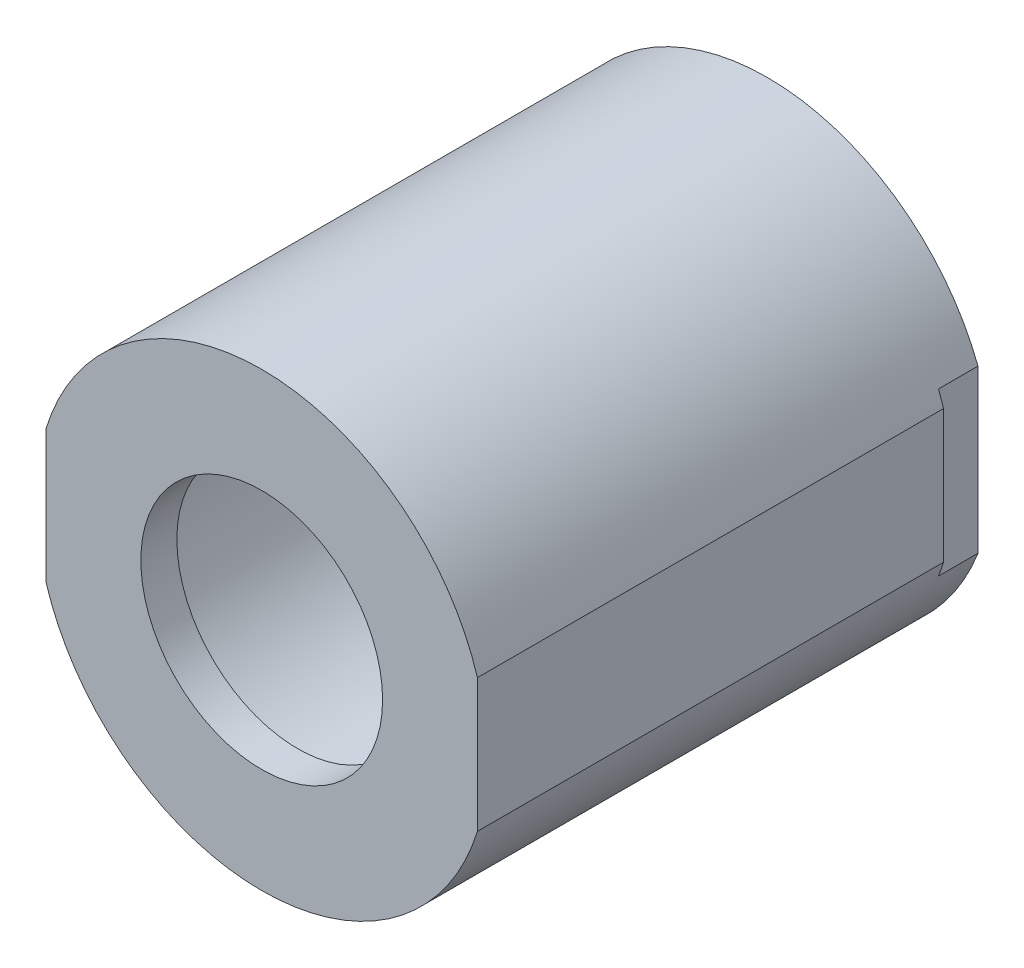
SolidWorks part; units mm, degrees
ref_plane "Front Plane" through (0, 0, 0) normal (0, 0, 1) x (1, 0, 0)
ref_plane "Top Plane" through (0, 0, 0) normal (0, 1, 0) x (1, 0, 0)
ref_plane "Right Plane" through (0, 0, 0) normal (1, 0, 0) x (0, 0, -1)
sketch "Sketch1" plane through (0, 0, 0) normal (0, 0, 1) x (1, 0, 0)
  circle A0 centre (0, 0) radius 28.575
  dimension "D1" = 57.15
extrude "Boss-Extrude1" add sketch "Sketch1" along normal blind 64
sketch "Sketch2" plane through (0, 0, 64) normal (0, 0, 1) x (1, 0, 0)
  circle A0 centre (0, 0) radius 15.3
  dimension "D1" = 30.6
extrude "Cut-Extrude1" cut sketch "Sketch2" against normal up to next
sketch "Sketch3" plane through (0, 0, 0) normal (0, 0, -1) x (-1, 0, 0)
  circle A0 centre (0, 0) radius 21.4312
  dimension "D1" = 42.8625
extrude "Cut-Extrude2" cut sketch "Sketch3" against normal blind 59
sketch "Sketch4" plane through (0, 0, 0) normal (0, 1, 0) x (1, 0, 0)
  line L0 (0, 0) -> (0, -60.96) construction
  line L2 (0, -59) -> (17, -59) construction
  line L3 (21.4312, -59) -> (-21.4312, -59) construction
  line L4 (17, -59) -> (15, -59.5187)
  line L5 (15, -59.5187) -> (15, -59)
  line L6 (15, -59) -> (17, -59)
  line L7 (0, -59.5187) -> (15, -59.5187) construction
  point P2 (16, -59.2594)
  dimension "D1" = 16
  dimension "D2" = 17
  dimension "D3" = 75.46
revolve "Cut-Revolve1" cut sketch "Sketch4" angle 360 about L0
sketch "Sketch5" plane through (0, 0, 0) normal (0, 0, -1) x (-1, 0, 0)
  line L0 (-27.305, -8.4242) -> (-27.305, 8.4242)
  line L1 (0, 0) -> (0, 50000) construction
  line L2 (27.305, -8.4242) -> (27.305, 8.4242)
  circle A0 centre (0, 0) radius 27.305 construction
  circle A1 centre (0, 0) radius 28.575 construction
  arc A2 (-27.305, 8.4242) -> (-27.305, -8.4242) centre (0, 0) ccw
  arc A3 (27.305, 8.4242) -> (27.305, -8.4242) centre (0, 0) cw
  dimension "D1" = 54.61
extrude "Cut-Extrude3" cut sketch "Sketch5" against normal through all
sketch "Sketch6" plane through (-27.305, 0, 0) normal (1, 0, 0) x (0, 0, -1)
  line L0 (0, -8.4242) -> (0, 8.4242) construction
  circle A0 centre (-31.75, 0) radius 1.3526
  dimension "D1" = 2.7051
  dimension "D2" = 31.75
extrude "Cut-Extrude4" [suppressed] cut sketch "Sketch6" along normal blind 4.699
sketch "Sketch7" plane through (0, 0, 0) normal (0, 0, -1) x (-1, 0, 0)
  line L0 (26.67, 10.2587) -> (26.67, -10.2587)
  line L1 (-26.67, 10.2587) -> (-26.67, -10.2587)
  circle A0 centre (0, 0) radius 26.67 construction
  arc A1 (-26.67, 10.2587) -> (-26.67, -10.2587) centre (0, 0) ccw
  arc A2 (27.305, 8.4242) -> (-27.305, 8.4242) centre (0, 0) ccw construction
  arc A3 (26.67, -10.2587) -> (26.67, 10.2587) centre (0, 0) ccw
  dimension "D1" = 53.34
extrude "Cut-Extrude5" cut sketch "Sketch7" against normal blind 5
